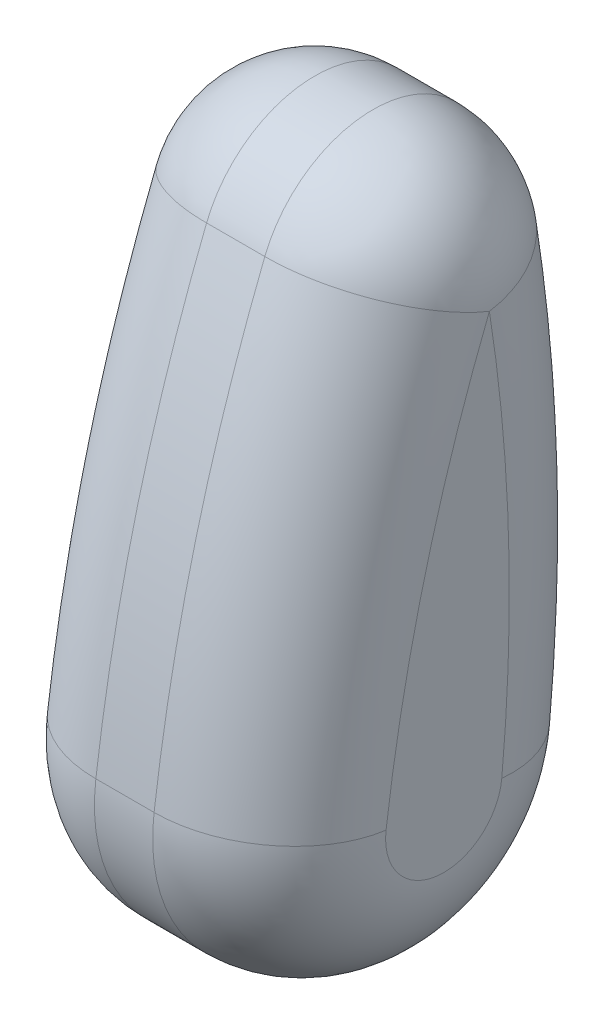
SolidWorks part; units mm, degrees
ref_plane "XY" through (0, 0, 0) normal (0, 0, 1) x (1, 0, 0)
ref_plane "YZ" through (0, 0, 0) normal (0, 1, 0) x (1, 0, 0)
ref_plane "XZ" through (0, 0, 0) normal (1, 0, 0) x (0, 0, -1)
sketch "Sketch8" plane through (0, 0, 0) normal (1, 0, 0) x (0, 0, -1)
  line L0 (5.9396, 192.7601) -> (25.8227, 369.4448) construction
  line L1 (0, 432.2232) -> (0, -432.2232) construction
  arc A0 (-69.6376, 202.4822) -> (81.7874, 185.4418) centre (5.9396, 192.7601) ccw
  arc A1 (76.0022, 377.3605) -> (-21.3425, 388.3151) centre (25.8227, 369.4448) ccw
  arc A2 (-69.6376, 202.4822) -> (-21.3425, 388.3151) centre (686.1348, 105.2605) cw
  arc A3 (76.0022, 377.3605) -> (81.7874, 185.4418) centre (-676.6902, 258.6247) cw
  dimension "D2" = 50.8
  dimension "D4" = 76.2
  dimension "D5" = 762
  dimension "D6" = 762
  dimension "D1" = 6.421
  dimension "D3" = 177.8
extrude "Base-Extrude" add sketch "Sketch8" along normal mid plane 127
fillet "Fillet1" radius 50.8 8 edges at (63.5, 281.5841, -84.9638) (63.5, 419.9262, -31.5035) (63.5, 296.9259, 51.3666) (-63.5, 419.9262, -31.5035) (-63.5, 281.5841, -84.9638) (-63.5, 117.038, 2.5817) (-63.5, 296.9259, 51.3666) (63.5, 117.038, 2.5817)
